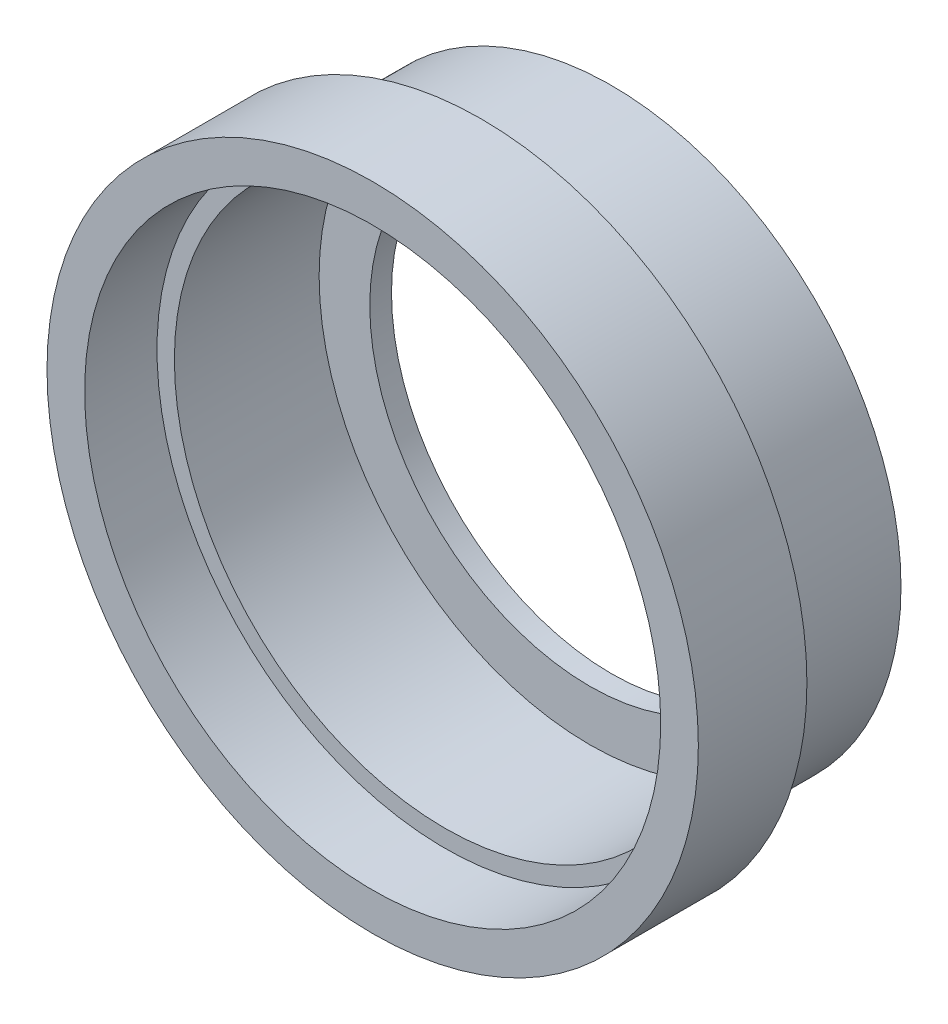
SolidWorks part; units mm, degrees
ref_plane "Front Plane" through (0, 0, 0) normal (0, 0, 1) x (1, 0, 0)
ref_plane "Top Plane" through (0, 0, 0) normal (0, 1, 0) x (1, 0, 0)
ref_plane "Right Plane" through (0, 0, 0) normal (1, 0, 0) x (0, 0, -1)
sketch "Sketch1" plane through (0, 0, 0) normal (0, 0, 1) x (1, 0, 0)
  circle A0 centre (0, 0) radius 25.4
extrude "Extrude1" add sketch "Sketch1" along normal blind 11.43
sketch "Sketch2" plane through (0, 0, 11.43) normal (0, 0, 1) x (1, 0, 0)
  circle A0 centre (0, 0) radius 28.575
extrude "Extrude2" add sketch "Sketch2" along normal blind 9.525
sketch "Sketch3" plane through (0, 0, 0) normal (0, 0, -1) x (-1, 0, 0)
  circle A0 centre (0, 0) radius 19.304
extrude "Cut-Extrude1" cut sketch "Sketch3" against normal through all
sketch "Sketch4" plane through (0, 0, 20.955) normal (0, 0, 1) x (1, 0, 0)
  circle A0 centre (0, 0) radius 25.273
extrude "Cut-Extrude3" cut sketch "Sketch4" against normal blind 6.35
sketch "Sketch5" plane through (0, 0, 14.605) normal (0, 0, 1) x (1, 0, 0)
  circle A0 centre (0, 0) radius 23.749
extrude "Cut-Extrude4" cut sketch "Sketch5" against normal blind 12.7
